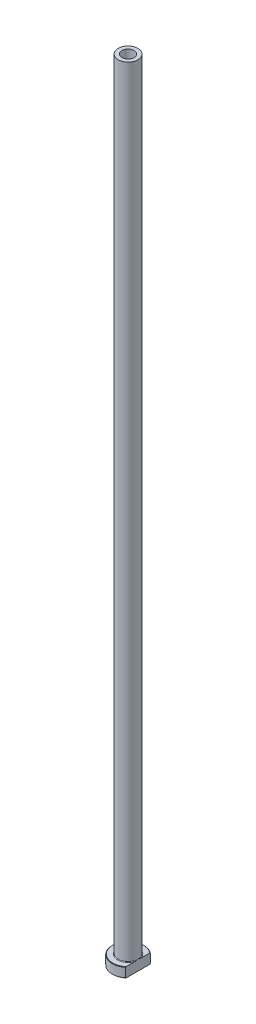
SolidWorks part; units mm, degrees
ref_plane "Front Plane" through (0, 0, 0) normal (0, 0, 1) x (1, 0, 0)
ref_plane "Top Plane" through (0, 0, 0) normal (0, 1, 0) x (1, 0, 0)
ref_plane "Right Plane" through (0, 0, 0) normal (1, 0, 0) x (0, 0, -1)
sketch "Sketch1" plane through (0, 0, 0) normal (0, 0, 1) x (1, 0, 0)
  line L0 (-3.1, 400) -> (-5, 400)
  line L1 (-5, 400) -> (-5, 5)
  line L2 (-5, 5) -> (-8, 5)
  line L3 (-8, 5) -> (-8, 0)
  line L4 (7.15, 0) -> (-7.15, 0) construction
  line L5 (-8, 0) -> (-3.35, 0)
  line L6 (-3.1, 355) -> (-3.1, 400)
  line L7 (0, 92.1877) -> (0, -15.5353) construction
  line L8 (0, -8.8) -> (0, 8.8) construction
  line L9 (-3.1, 355) -> (-3.35, 343)
  line L10 (-3.35, 343) -> (-3.35, 0)
  dimension "D1" = 0.25
  dimension "ID" = 6.2
  dimension "OD" = 10
  dimension "L" = 400
  dimension "H" = 16
  dimension "T" = 5
  dimension "N" = 45
  dimension "D2" = 12
  dimension "L-N" = 355
revolve "Revolve1" add sketch "Sketch1" angle 360 about L7
fillet "Fillet1" radius 0.3 1 edges at (0, 5, 5)
chamfer "Chamfer1" distance 0.2 angle 45 2 edges at (0, 5, 8) (0, 0, 8)
sketch "Sketch2" plane through (0, 0, 0) normal (0, -1, 0) x (1, 0, 0)
  line L0 (5, 6.245) -> (5, -6.245)
  circle A0 centre (0, 0) radius 8 construction
  arc A1 (5, 6.245) -> (5, -6.245) centre (0, 0) cw
  circle A2 centre (0, 0) radius 5 construction
extrude "Cut-Extrude1" cut sketch "Sketch2" against normal through all
chamfer "Chamfer2" distance 0.5 angle 45 1 edges at (0, 0, 3.35)
